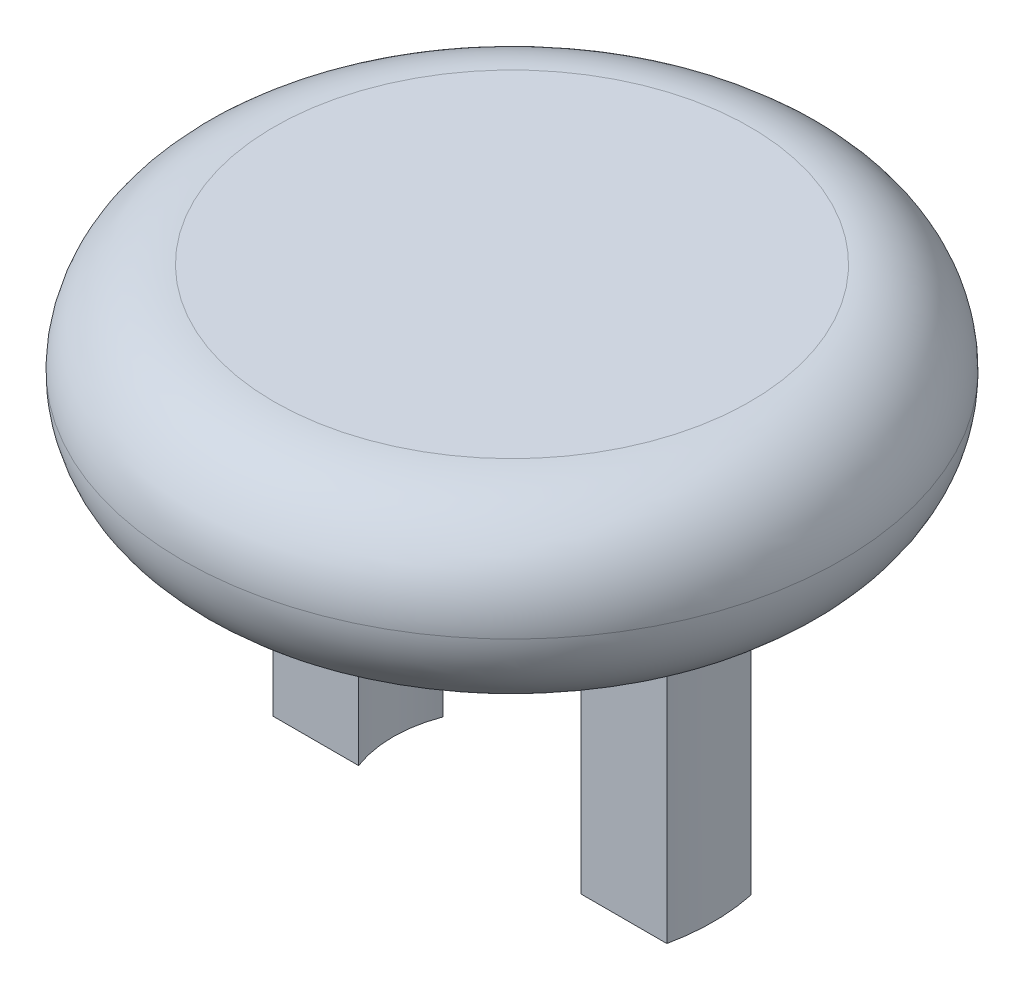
SolidWorks part; units mm, degrees
ref_plane "Plan de face" through (0, 0, 0) normal (0, 0, 1) x (1, 0, 0)
ref_plane "Plan de dessus" through (0, 0, 0) normal (0, 1, 0) x (1, 0, 0)
ref_plane "Plan de droite" through (0, 0, 0) normal (1, 0, 0) x (0, 0, -1)
sketch "Esquisse1" plane through (0, 0, 0) normal (0, 1, 0) x (1, 0, 0)
  circle A0 centre (0, 0) radius 9
  dimension "D1" = 18
extrude "Boss.-Extru.1" add sketch "Esquisse1" along normal blind 5
fillet "Congé1" radius 2.5 2 edges at (0, 0, 9) (0, 5, 9)
sketch "Esquisse2" plane through (0, 0, 0) normal (0, -1, 0) x (1, 0, 0)
  circle A0 centre (0, 0) radius 5.5
  circle A1 centre (0, 0) radius 3.25
  dimension "D1" = 11
  dimension "D2" = 6.5
extrude "Boss.-Extru.2" add sketch "Esquisse2" along normal blind 0.3
sketch "Esquisse4" plane through (0, -0.3, 0) normal (0, -1, 0) x (1, 0, 0)
  line L0 (-5.3784, 1.15) -> (-3.0397, 1.15)
  line L1 (-5.3784, -1.15) -> (-3.0397, -1.15)
  line L2 (-10.98, 0) -> (11.5476, 0) construction
  line L3 (3.0397, 1.15) -> (5.3784, 1.15)
  line L4 (3.0397, -1.15) -> (5.3784, -1.15)
  circle A0 centre (0, 0) radius 5.5 construction
  circle A1 centre (0, 0) radius 5.5 construction
  circle A2 centre (0, 0) radius 3.25 construction
  arc A3 (-3.0397, 1.15) -> (-3.0397, -1.15) centre (0, 0) ccw
  arc A4 (-5.3784, 1.15) -> (-5.3784, -1.15) centre (0, 0) ccw
  arc A5 (3.0397, -1.15) -> (3.0397, 1.15) centre (0, 0) ccw
  arc A6 (5.3784, -1.15) -> (5.3784, 1.15) centre (0, 0) ccw
  dimension "D1" = 2.3
extrude "Boss.-Extru.3" add sketch "Esquisse4" along normal blind 7.5
hole_wizard "Trou taraudé M41" positions "Esquisse6" profile "Esquisse5" tap size "M4" standard "ISO"
sketch "Esquisse6" plane through (0, 0, 0) normal (0, -1, 0) x (-1, 0, 0)
  point P0 (0, 0)
sketch "Esquisse5" plane through (0, 0, 0) normal (1, 0, 0) x (0, 0, -1)
  line L0 (0, 0) -> (0, 4.6006)
  line L1 (0, 4.6006) -> (1.65, 4)
  line L2 (1.65, 4) -> (1.65, 0)
  line L5 (1.65, 0) -> (0, 0)
  line L10 (0, 4.6006) -> (-1.65, 4) construction
  line L11 (0, -6.35) -> (0, 107.95) construction
  dimension "Diamètre du trou pour taraudage" = 3.3
  dimension "Profondeur du trou pour taraudage" = 4
  dimension "Angle de pointe" = 140
